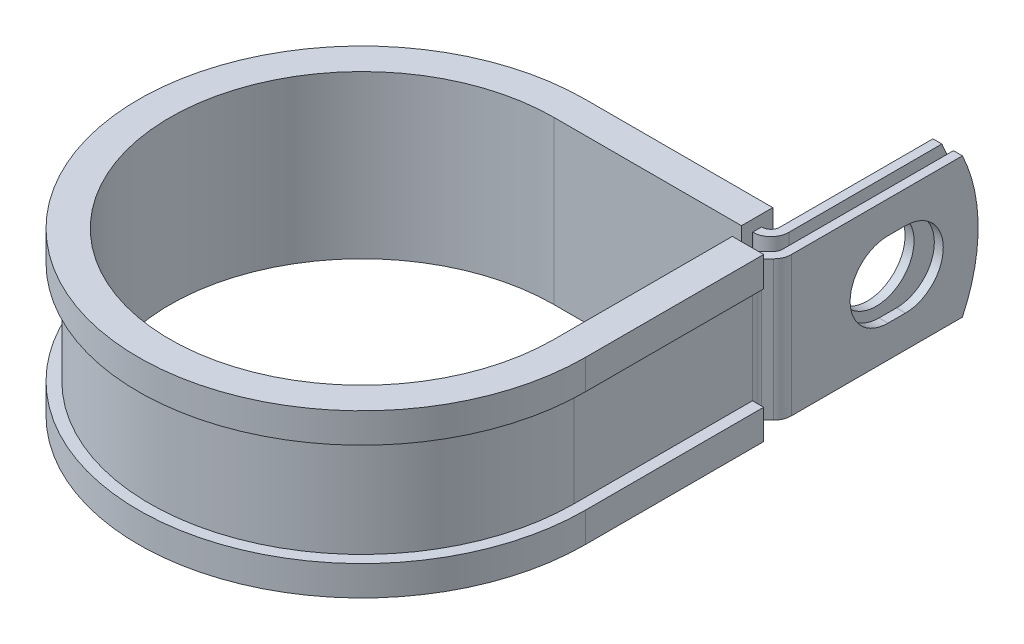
SolidWorks part; units mm, degrees
ref_plane "Front Plane" through (0, 0, 0) normal (0, 0, 1) x (1, 0, 0)
ref_plane "Top Plane" through (0, 0, 0) normal (0, 1, 0) x (1, 0, 0)
ref_plane "Right Plane" through (0, 0, 0) normal (1, 0, 0) x (0, 0, -1)
sketch "Sketch1" plane through (0, 0, 0) normal (0, 1, 0) x (1, 0, 0)
  line L0 (0, 27.7114) -> (25.5957, 27.7114)
  line L1 (27.7114, 0) -> (27.7114, 24.2989)
  line L2 (28.0341, 53.1622) -> (28.0341, 30.1498)
  line L3 (28.4256, 26.0231) -> (29.2518, 26.8493)
  line L5 (29.6089, 27.7114) -> (29.6089, 53.1622)
  arc A0 (0, 27.7114) -> (27.7114, 0) centre (0, 0) ccw
  arc A1 (28.4256, 26.0231) -> (27.7114, 24.2989) centre (30.1498, 24.2989) ccw
  arc A2 (29.2518, 26.8493) -> (29.6089, 27.7114) centre (28.3897, 27.7114) ccw
  arc A3 (25.5957, 27.7114) -> (28.0341, 30.1498) centre (25.5957, 30.1498) ccw
extrude "Extrude-Thin1" add sketch "Sketch1" along normal mid plane 19.05 thin
sketch "Sketch2" plane through (26.8149, 0, 0) normal (-1, 0, 0) x (0, 0, 1)
  line L0 (-53.1622, 9.525) -> (-53.1622, -9.525) construction
  line L1 (0, 9.525) -> (0, -9.525) construction
  circle A0 centre (-42.0624, 0) radius 5.1562
  point P2 (-53.1622, 0)
extrude "Cut-Extrude1" cut sketch "Sketch2" against normal up to surface (1.2192 mm away)
sketch "Sketch3" plane through (30.8281, 0, 0) normal (1, 0, 0) x (0, 0, -1)
  line L0 (40.8686, 0) -> (43.2562, 0) construction
  line L1 (40.8686, 5.1562) -> (43.2562, 5.1562)
  line L2 (40.8686, -5.1562) -> (43.2562, -5.1562)
  line L3 (53.1622, 9.525) -> (53.1622, -9.525) construction
  arc A0 (40.8686, 5.1562) -> (40.8686, -5.1562) centre (40.8686, 0) ccw
  arc A1 (43.2562, -5.1562) -> (43.2562, 5.1562) centre (43.2562, 0) ccw
  point P3 (42.0624, 0)
  point P8 (53.1622, 0)
  point P11 (35.7124, 0)
  point P12 (48.4124, 0)
extrude "Cut-Extrude2" cut sketch "Sketch3" against normal up to surface (1.2192 mm away)
sketch "Sketch4" plane through (26.8149, 0, 0) normal (-1, 0, 0) x (0, 0, 1)
  line L0 (-53.1622, 9.525) -> (-53.1622, -9.525)
  line L1 (-53.1622, 9.525) -> (-51.0177, 9.525)
  line L2 (-53.1622, 9.525) -> (-30.1498, 9.525) construction
  line L3 (-53.1622, -9.525) -> (-51.0177, -9.525)
  line L4 (-53.1622, -9.525) -> (-30.1498, -9.525) construction
  arc A0 (-51.0177, 9.525) -> (-51.0177, -9.525) centre (-30.9372, 0) ccw
extrude "Cut-Extrude3" cut sketch "Sketch4" against normal through all contours A0 M4 M5 | A0 L0 M2
ref_plane "Plane1" through (0, 0, -24.2989) normal (0, 0, -1) x (-1, 0, 0)
ref_plane "Plane2" through (25.5449, 0, 0) normal (-1, 0, 0) x (0, 0, 1)
sketch "Sketch5" plane through (0, 0, -24.2989) normal (0, 0, -1) x (-1, 0, 0)
  line L0 (-28.9306, 9.525) -> (-27.7114, 9.525)
  line L1 (-28.9306, 9.525) -> (-28.9306, -9.525) construction
  line L3 (-27.7114, 9.525) -> (-27.7114, -9.525)
  line L4 (-27.7114, -9.525) -> (-28.9306, -9.525)
  line L5 (-28.9306, -9.525) -> (-28.9306, -6.985)
  line L6 (-28.9306, 9.525) -> (-28.9306, 6.985)
  line L7 (-30.4546, 11.049) -> (-30.4546, 6.985)
  line L8 (-30.4546, 11.049) -> (-26.1874, 11.049)
  line L9 (-26.1874, 11.049) -> (-26.1874, -11.049)
  line L10 (-26.1874, -11.049) -> (-30.4546, -11.049)
  line L11 (-30.4546, -11.049) -> (-30.4546, -6.985)
  line L12 (-30.4546, 6.985) -> (-28.9306, 6.985)
  line L13 (-28.9306, -6.985) -> (-30.4546, -6.985)
sketch "Sketch6" plane through (0, 9.525, 0) normal (0, 1, 0) x (1, 0, 0)
  line L0 (26.1874, 0) -> (26.1874, 24.2989)
  line L1 (26.1874, 24.2989) -> (30.4546, 24.2989) construction
  line L2 (25.5449, 6.9878) -> (25.5449, -6.9878) construction
  line L5 (0, 26.1874) -> (25.5449, 26.1874)
  arc A0 (0, 26.1874) -> (26.1874, 0) centre (0, 0) ccw
sweep "Sweep1" add profiles "Sketch5" path "Sketch6"
equation "\"D4@Sketch5\" = \"D1@Extrude-Thin1\""
equation "\"D5@Sketch5\" = \"D5@Extrude-Thin1\""
equation "\"D1@Sketch3\" = \"D2@Sketch2\""
equation "\"D7@Sketch1\" = \"D3@Sketch2\" + \"D1@Sketch3\""
equation "\"D1@Sketch1\" = \"D1@Sketch6\" + 2 * \"D3@Sketch5\""
equation "\"D1@Sketch4\" = ( \"D1@Extrude-Thin1\" + .125 ) * 2"
equation "\"D9@Sketch1\"= \"D5@Extrude-Thin1\""
equation "\"D8@Sketch1\"= 2 * \"D5@Extrude-Thin1\""
equation "\"D2@Sketch1\" = 2 * \"D5@Extrude-Thin1\""
equation "\"D2@Sketch3\" = \"D1@Sketch2\""
